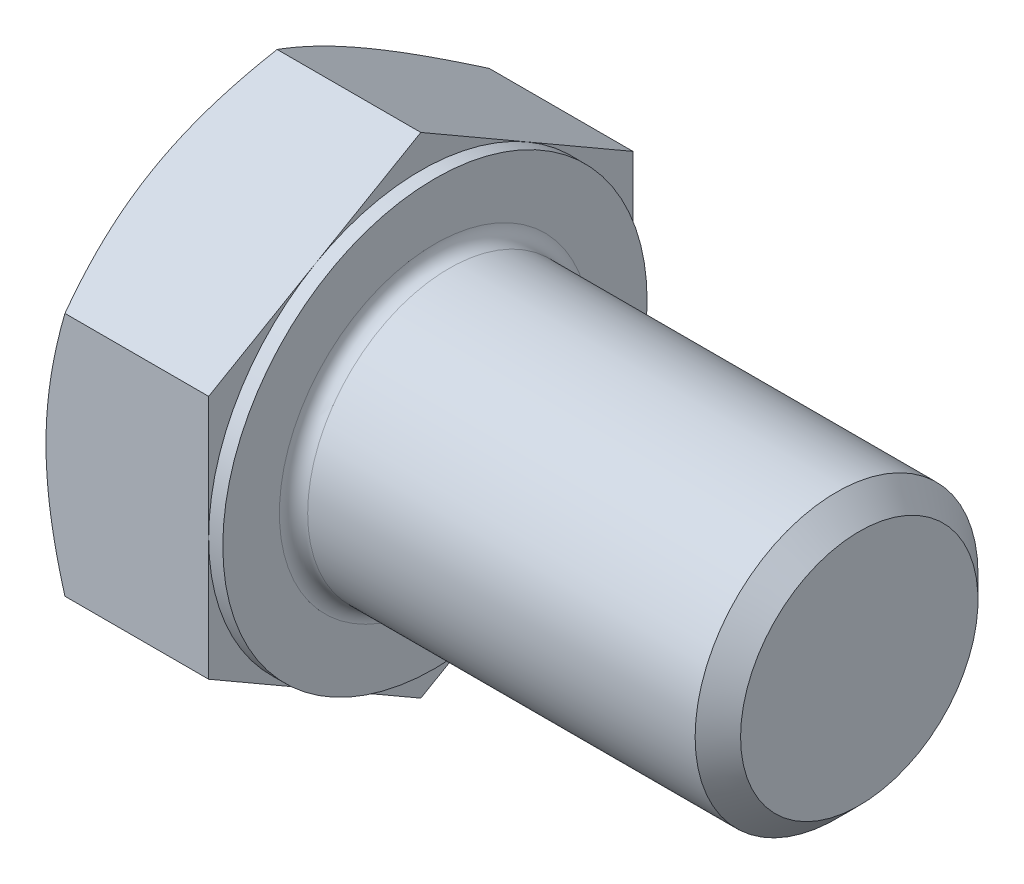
SolidWorks part; units mm, degrees
ref_plane "Plane1" through (0, 0, 0) normal (0, 0, 1) x (1, 0, 0)
ref_plane "Plane2" through (0, 0, 0) normal (0, 1, 0) x (1, 0, 0)
ref_plane "Plane3" through (0, 0, 0) normal (1, 0, 0) x (0, 0, -1)
sketch "Sketch1" plane through (0, 0, 0) normal (1, 0, 0) x (0, 0, -1)
  line L0 (9, 5.1962) -> (9, -5.1962)
  line L1 (-9, 5.1962) -> (-9, -5.1962)
  line L2 (9, -5.1962) -> (0, -10.3923)
  line L3 (0, -10.3923) -> (-9, -5.1962)
  line L4 (9, 5.1962) -> (0, 10.3923)
  line L5 (0, 10.3923) -> (-9, 5.1962)
  dimension "Width_flats" = 18
  dimension "D2" = 120
  dimension "D3" = 9
  dimension "D4" = 9
  dimension "D5" = 9
extrude "BaseHead" add sketch "Sketch1" along normal blind 7.5
sketch "BodySke" plane through (0, 0, 0) normal (0, 0, 1) x (1, 0, 0)
  line L0 (0, 5.1962) -> (0, -5.1962) construction
  line L1 (0, 0) -> (25.5, 0)
  line L2 (0, 0) -> (0, 6)
  line L3 (0, 6) -> (24.536, 6)
  line L4 (25.5, 0) -> (25.5, 5.036)
  line L5 (7.5, 10.3923) -> (7.5, 5.1962) construction
  line L6 (25.5, 5.036) -> (24.536, 6)
  line L7 (0, 0) -> (96.52, 0) construction
  line L8 (25.5, -5.036) -> (24.536, -6) construction
  line L9 (0, -6) -> (24.536, -6) construction
  line L10 (9.25, 15.24) -> (9.25, -1.27) construction
  line L11 (9.5, 15.24) -> (9.5, -1.27) construction
  line L12 (7.5, 5.1962) -> (7.5, -5.1962) construction
  dimension "Length" = 18
  dimension "Body_ch_ang" = 45
  dimension "Diameter" = 12
  dimension "Minor_dia" = 10.072
  dimension "Advance" = 1.75
  dimension "Thread_nom" = 16
revolve "BaseBody" add sketch "BodySke"
fillet "HeadFillet" radius 0.6 1 edges at (7.5, 0, -6)
sketch "Sketch3" plane through (0, 0, 0) normal (0, 0, 1) x (1, 0, 0)
  line L0 (0, 9) -> (3.6906, 15.3923)
  line L1 (0, 10.3923) -> (0, 5.1962) construction
  line L2 (3.6906, 15.3923) -> (3.6906, 20.3923)
  line L3 (3.6906, 20.3923) -> (-10, 20.3923)
  line L4 (-10, 20.3923) -> (-10, 9)
  line L5 (-10, 9) -> (0, 9)
  line L6 (0, 0) -> (99.06, 0) construction
  line L7 (7.5, 10.3923) -> (0, 10.3923) construction
  dimension "D1" = 9
  dimension "D2" = 5
  dimension "D3" = 10
  dimension "D4" = 5
  dimension "Head_ch_ang" = 30
revolve "HeadChamfer" cut sketch "Sketch3" angle 360 about L6
sketch "Sketch4" plane through (0, 0, 0) normal (0, 0, 1) x (1, 0, 0)
  line L1 (7.5, 10.3923) -> (7.5, 5.1962) construction
  line L2 (7.5, 9) -> (6.9, 9)
  line L3 (7.5, 9) -> (7.5, 20.3923)
  line L4 (7.5, 20.3923) -> (6.9, 20.3923)
  line L5 (0, 0) -> (95.25, 0) construction
  line L6 (0, 0) -> (96.52, 0) construction
  line L7 (6.9, 9) -> (6.9, 20.3923)
  line L8 (7.5, 10.3923) -> (0.8038, 10.3923) construction
  dimension "D1" = 18
  dimension "D2" = 10
  dimension "Bearing_ht" = 0.6
revolve "BearingFace" cut sketch "Sketch4" angle 360 about L5
sketch "ThdSchSke" plane through (0, 0, 0) normal (0, 0, 1) x (1, 0, 0)
  line L0 (9.5, -5.036) -> (8.825, -6)
  line L1 (9.5, -5.036) -> (10.175, -6)
  line L2 (10.175, -6) -> (10.175, -7.5)
  line L3 (-3.175, 0) -> (5.1513, 0) construction
  line L5 (10.175, -7.5) -> (8.825, -7.5)
  line L6 (8.825, -7.5) -> (8.825, -6)
  dimension "Thread_minor" = 10.072
  dimension "Diameter" = 12
  dimension "Start" = 9.5
  dimension "SideAngle" = 55
  dimension "VeeAngle" = 70
  dimension "Overcut" = 15
revolve "ThreadSchematic" [suppressed] cut sketch "ThdSchSke" angle 360 about L3
pattern_linear "ThdSchPat" [suppressed]
equation "\"D3@Sketch1\" = \"Width_flats@Sketch1\" / 2"
equation "\"D4@Sketch1\" = \"D3@Sketch1\""
equation "\"D5@Sketch1\" = \"D4@Sketch1\""
equation "\"Thread_minor@ThreadCosmetic\" = \"Minor_dia@BodySke\""
equation "\"D1@Sketch3\" = \"Width_flats@Sketch1\" / 2"
equation "\"D1@Sketch4\" = \"Width_flats@Sketch1\""
equation "\"Thread_length@ThreadCosmetic\" = ((sgn( (\"Length@BodySke\" - \"Advance@BodySke\" ) - \"Thread_nom@BodySke\" )-1)*( (\"Length@BodySke\" - \"Advance@BodySke\" ) - \"Thread_nom@BodySke\" ))/-2+ \"Thread_nom@BodySke\""
equation "\"Thread_minor@ThdSchSke\" = \"Minor_dia@BodySke\""
equation "\"Diameter@ThdSchSke\" = \"Diameter@BodySke\""
equation "\"Overcut@ThdSchSke\" = \"Diameter@BodySke\" * 1.25"
equation "\"Start@ThdSchSke\" = \"Head_ht@BaseHead\" + \"Length@BodySke\" - \"Thread_length@ThreadCosmetic\"  '---Non-countersunk---"
equation "\"Num_threads@ThdSchPat\" = int( \"Thread_length@ThreadCosmetic\" / \"Advance@BodySke\" + 0.999 )  + 1"
equation "\"Advance@ThdSchPat\" = \"Thread_length@ThreadCosmetic\" /  (\"Num_threads@ThdSchPat\" - 1) 'relax it"
equation "\"Num_threads@ThdSchPat\" = \"Num_threads@ThdSchPat\" - sgn( \"Num_threads@ThdSchPat\" - 1) '---chamfered tips only---"
